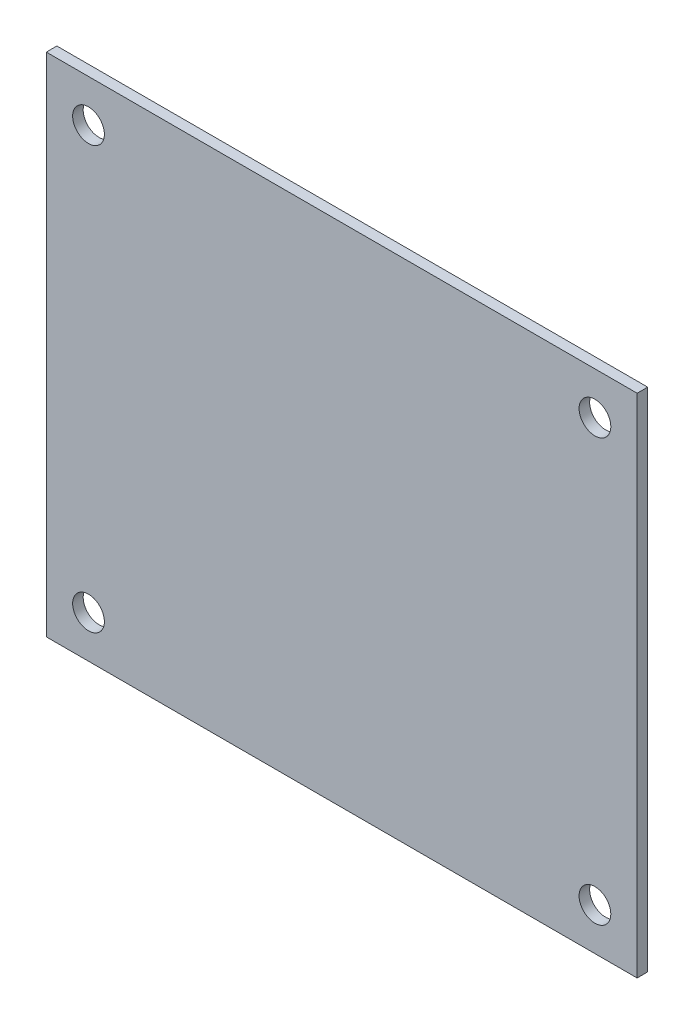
SolidWorks part; units mm, degrees
ref_plane "Front Plane" through (0, 0, 0) normal (0, 0, 1) x (1, 0, 0)
ref_plane "Top Plane" through (0, 0, 0) normal (0, 1, 0) x (1, 0, 0)
ref_plane "Right Plane" through (0, 0, 0) normal (1, 0, 0) x (0, 0, -1)
sketch "Sketch1" plane through (0, 0, 0) normal (0, 0, 1) x (1, 0, 0)
  line L1 (-44.45, -38.1) -> (44.45, -38.1)
  line L2 (-44.45, -38.1) -> (-44.45, 38.1)
  line L3 (-44.45, 38.1) -> (44.45, 38.1)
  line L4 (44.45, -38.1) -> (44.45, 38.1)
  line L5 (-44.45, -38.1) -> (44.45, 38.1) construction
  line L6 (-44.45, 38.1) -> (44.45, -38.1) construction
  line L7 (38.1, -31.75) -> (-38.1, -31.75) construction
  line L8 (38.1, -31.75) -> (38.1, 31.75) construction
  line L9 (38.1, 31.75) -> (-38.1, 31.75) construction
  line L10 (-38.1, -31.75) -> (-38.1, 31.75) construction
  line L11 (38.1, -31.75) -> (-38.1, 31.75) construction
  line L12 (38.1, 31.75) -> (-38.1, -31.75) construction
  circle A0 centre (-38.1, 31.75) radius 2.3876
  circle A1 centre (-38.1, -31.75) radius 2.3876
  circle A2 centre (38.1, -31.75) radius 2.3876
  circle A3 centre (38.1, 31.75) radius 2.3876
  point P0 (0, 0)
  point P14 (0, 0)
  dimension "D3" = 4.7752
  dimension "D1" = 88.9
  dimension "D2" = 76.2
  dimension "D4" = 76.2
  dimension "D5" = 63.5
extrude "Boss-Extrude1" add sketch "Sketch1" along normal blind 1.5875
sketch "Sketch2" plane through (0, 0, 0) normal (0, 0, -1) x (-1, 0, 0)
  line L0 (18.9104, -23.4142) -> (-19.5232, -23.4142) construction
  text T0 "DC1940A DC/DC"
extrude "Cut-Extrude1" cut sketch "Sketch2" against normal blind 0.127
